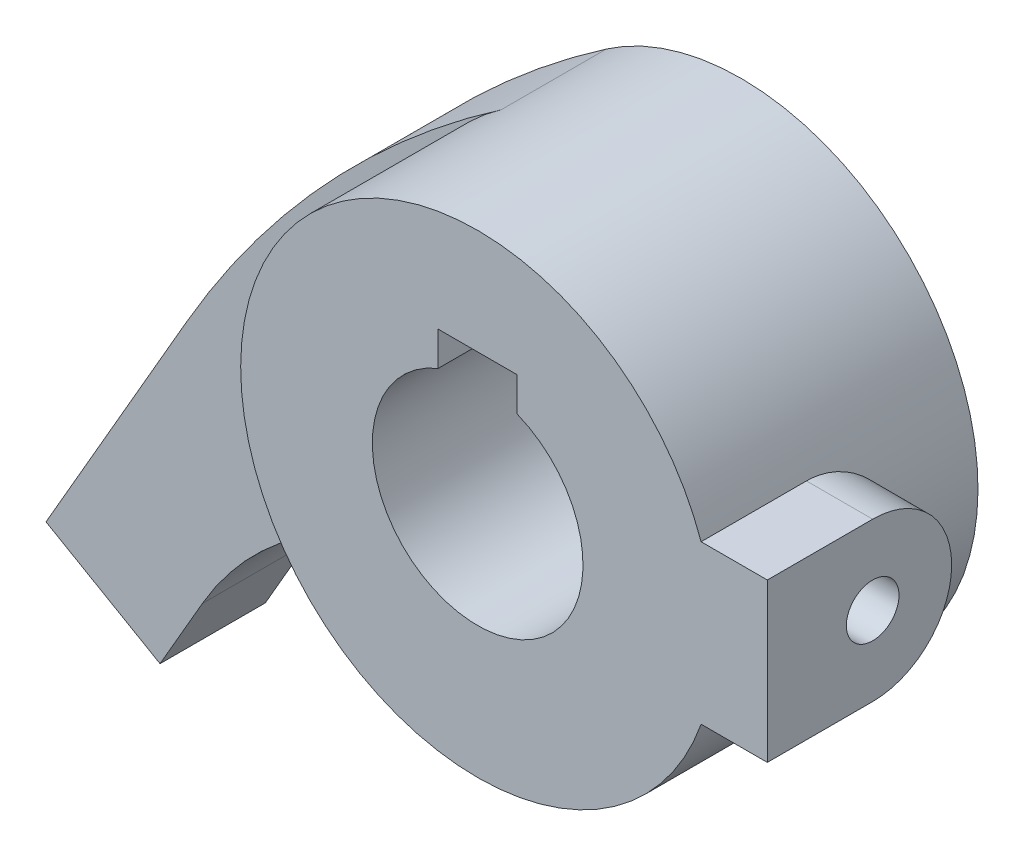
SolidWorks part; units mm, degrees
ref_plane "前视基准面" through (0, 0, 0) normal (0, 0, 1) x (1, 0, 0)
ref_plane "上视基准面" through (0, 0, 0) normal (0, 1, 0) x (1, 0, 0)
ref_plane "右视基准面" through (0, 0, 0) normal (1, 0, 0) x (0, 0, -1)
sketch "草图1" plane through (0, 0, 0) normal (0, 0, 1) x (1, 0, 0)
  line L0 (0, 11.715) -> (0, -12.6704) construction
  line L1 (-12.634, 0) -> (12.1078, 0) construction
  line L2 (-3, 7.4162) -> (-3, 10)
  line L3 (-3, 10) -> (3, 10)
  line L4 (3, 7.4162) -> (3, 10)
  arc A0 (-3, 7.4162) -> (3, 7.4162) centre (0, 0) ccw
  circle A1 centre (0, 0) radius 18
  point P13 (0, 10)
  dimension "D1" = 36
  dimension "D2" = 16
  dimension "D4" = 10
  dimension "D3" = 6
extrude "凸台-拉伸1" add sketch "草图1" along normal blind 20
ref_plane "基准面1" through (22, 0, 0) normal (1, 0, 0) x (0, 0, -1)
sketch "草图2" plane through (22, 0, 0) normal (1, 0, 0) x (0, 0, -1)
  line L0 (-24.8754, 0) -> (-6.9723, 0) construction
  line L1 (-12, 6.7466) -> (-12, -9.8402) construction
  line L2 (-20, 18) -> (-20, -18) construction
  line L3 (-12, 6) -> (-20, 6)
  line L4 (-12, -6) -> (-20, -6)
  line L5 (-20, 6) -> (-20, -6)
  circle A0 centre (-12, 0) radius 2
  arc A1 (-12, -6) -> (-12, 6) centre (-12, 0) ccw
  dimension "D1" = 6
  dimension "D2" = 4
  dimension "D3" = 8
extrude "凸台-拉伸2" add sketch "草图2" against normal up to next
sketch "草图3" plane through (0, 0, 0) normal (0, 0, 1) x (1, 0, 0)
  line L0 (-34.0887, -11.0434) -> (-44.7846, -29.5692)
  line L1 (-32.909, -29) -> (-36.1244, -34.5692)
  line L2 (-64.6804, -18.0824) -> (-14.5619, -47.0183) construction
  line L3 (0, 0) -> (-40.1698, -69.5762) construction
  line L4 (0, 0) -> (-50.4077, 29.1029) construction
  line L5 (-44.7846, -29.5692) -> (-36.1244, -34.5692)
  arc A0 (-10.2174, 14.8191) -> (-4.7128, -17.3721) centre (0, 0) ccw
  arc A1 (-4.7128, -17.3721) -> (-32.909, -29) centre (-11.2583, -41.5) ccw
  arc A2 (-10.2174, 14.8191) -> (-34.0887, -11.0434) centre (35.1933, -51.0434) ccw
  dimension "D4" = 50
  dimension "D5" = 36
  dimension "D6" = 160
  dimension "D1" = 48
  dimension "D2" = 24
  dimension "D3" = 14
extrude "凸台-拉伸3" add sketch "草图3" along normal blind 8
ref_plane "基准面2" through (-20.7846, 12, 0) normal (-0.866, 0.5, 0) x (0, 0, 1)
sketch "草图4" plane through (-20.7846, 12, 0) normal (-0.866, 0.5, 0) x (0, 0, 1)
  line L0 (-10.5902, -48) -> (19.4775, -48) construction
  line L1 (4.4436, -35.1861) -> (4.4436, -67.7123)
  circle A0 centre (4.4436, -48) radius 4
  circle A1 centre (4.4436, -48) radius 10
  dimension "D1" = 8
  dimension "D2" = 20
